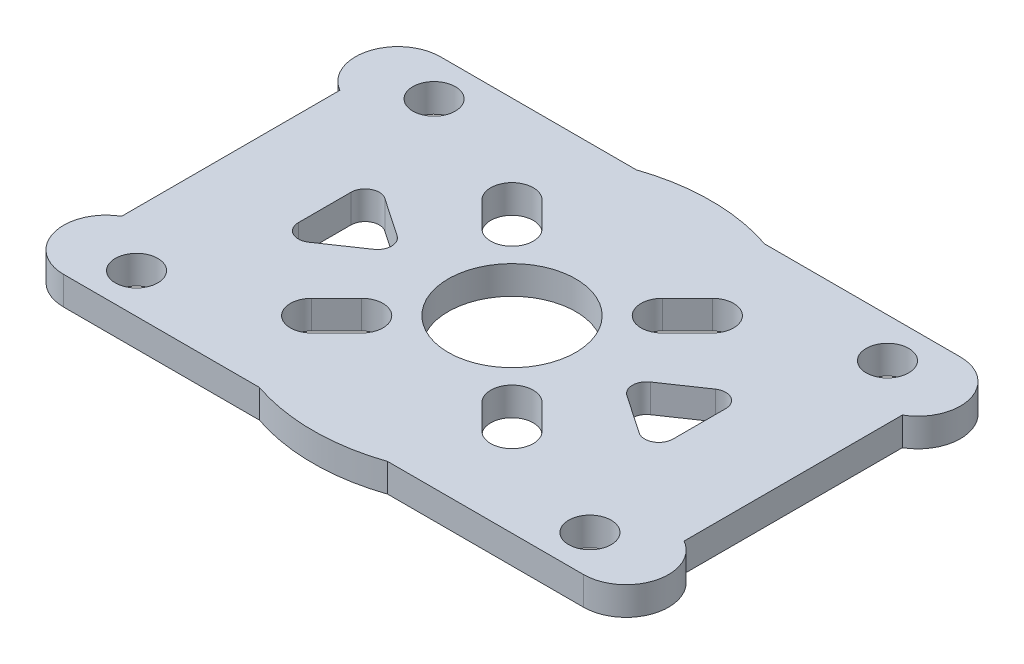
SolidWorks part; units mm, degrees
ref_plane "Front Plane" through (0, 0, 0) normal (0, 0, 1) x (1, 0, 0)
ref_plane "Top Plane" through (0, 0, 0) normal (0, 1, 0) x (1, 0, 0)
ref_plane "Right Plane" through (0, 0, 0) normal (1, 0, 0) x (0, 0, -1)
sketch "Sketch1" plane through (0, 0, 0) normal (0, 1, 0) x (1, 0, 0)
  line L0 (0, -55) -> (0, 55) construction
  line L1 (-18.35, -13.3) -> (-4.5291, -13.3)
  line L2 (-21.35, -10.3) -> (-21.35, 10.3) construction
  line L3 (-18.35, 13.3) -> (-4.5291, 13.3)
  line L4 (21.35, -10.3) -> (21.35, 10.3) construction
  line L5 (-55, 0) -> (55, 0) construction
  line L10 (-7.0711, 7.0711) -> (-5.3033, 5.3033) construction
  line L11 (-6.0104, 8.1317) -> (-4.2426, 6.364)
  line L12 (-8.1317, 6.0104) -> (-6.364, 4.2426)
  line L13 (7.0711, 7.0711) -> (5.3033, 5.3033) construction
  line L14 (8.1317, 6.0104) -> (6.364, 4.2426)
  line L15 (6.0104, 8.1317) -> (4.2426, 6.364)
  line L16 (7.0711, -7.0711) -> (5.3033, -5.3033) construction
  line L17 (6.0104, -8.1317) -> (4.2426, -6.364)
  line L18 (8.1317, -6.0104) -> (6.364, -4.2426)
  line L19 (-7.0711, -7.0711) -> (-5.3033, -5.3033) construction
  line L20 (-8.1317, -6.0104) -> (-6.364, -4.2426)
  line L21 (-6.0104, -8.1317) -> (-4.2426, -6.364)
  line L22 (4.5291, 13.3) -> (18.35, 13.3)
  line L23 (-19.85, 7.7019) -> (-19.85, -7.7019)
  line L24 (4.5291, -13.3) -> (18.35, -13.3)
  line L25 (19.85, 7.7019) -> (19.85, -7.7019)
  line L26 (-13.2249, 1.8579) -> (-13.2249, -1.8579)
  line L27 (-11.6615, -2.6841) -> (-8.9367, -0.8262)
  line L28 (-8.9367, 0.8262) -> (-11.6615, 2.6841)
  line L29 (11.6615, -2.6841) -> (8.9367, -0.8262)
  line L30 (13.2249, 1.8579) -> (13.2249, -1.8579)
  line L31 (8.9367, 0.8262) -> (11.6615, 2.6841)
  circle A0 centre (-16, 10.5) radius 1.5
  circle A1 centre (-16, -10.5) radius 1.5
  circle A2 centre (16, -10.5) radius 1.5
  circle A3 centre (16, 10.5) radius 1.5
  circle A4 centre (0, 0) radius 4.5
  arc A5 (-6.0104, 8.1317) -> (-8.1317, 6.0104) centre (-7.0711, 7.0711) ccw
  arc A6 (-6.364, 4.2426) -> (-4.2426, 6.364) centre (-5.3033, 5.3033) ccw
  arc A7 (8.1317, 6.0104) -> (6.0104, 8.1317) centre (7.0711, 7.0711) ccw
  arc A8 (4.2426, 6.364) -> (6.364, 4.2426) centre (5.3033, 5.3033) ccw
  arc A9 (6.0104, -8.1317) -> (8.1317, -6.0104) centre (7.0711, -7.0711) ccw
  arc A10 (6.364, -4.2426) -> (4.2426, -6.364) centre (5.3033, -5.3033) ccw
  arc A11 (-8.1317, -6.0104) -> (-6.0104, -8.1317) centre (-7.0711, -7.0711) ccw
  arc A12 (-4.2426, -6.364) -> (-6.364, -4.2426) centre (-5.3033, -5.3033) ccw
  arc A14 (4.5291, 13.3) -> (-4.5291, 13.3) centre (0, 0) ccw
  arc A15 (-4.5291, -13.3) -> (4.5291, -13.3) centre (0, 0) ccw
  arc A16 (-8.9367, 0.8262) -> (-8.9367, -0.8262) centre (-9.5, 0) cw
  arc A17 (-11.6615, -2.6841) -> (-13.2249, -1.8579) centre (-12.2249, -1.8579) cw
  arc A18 (-11.6615, 2.6841) -> (-13.2249, 1.8579) centre (-12.2249, 1.8579) ccw
  arc A19 (11.6615, -2.6841) -> (13.2249, -1.8579) centre (12.2249, -1.8579) ccw
  arc A20 (8.9367, 0.8262) -> (8.9367, -0.8262) centre (9.5, 0) ccw
  arc A21 (11.6615, 2.6841) -> (13.2249, 1.8579) centre (12.2249, 1.8579) cw
  arc A22 (-18.35, 13.3) -> (-19.85, 7.7019) centre (-18.35, 10.3) ccw
  arc A23 (-19.85, -7.7019) -> (-18.35, -13.3) centre (-18.35, -10.3) ccw
  arc A24 (19.85, 7.7019) -> (18.35, 13.3) centre (18.35, 10.3) ccw
  arc A25 (18.35, -13.3) -> (19.85, -7.7019) centre (18.35, -10.3) ccw
  point P8 (21.35, 0)
  point P23 (-6.1872, 6.1872)
  point P33 (6.1872, 6.1872)
  point P40 (6.1872, -6.1872)
  point P47 (-6.1872, -6.1872)
  point P52 (0, 0)
  point P55 (-13.2249, 0)
  point P60 (-7.7249, 0)
  point P63 (-13.2249, -3.75)
  point P66 (-13.2249, 3.75)
  dimension "D4" = 3
  dimension "D5" = 9
  dimension "D11" = 14.05
  dimension "D14" = 1
  dimension "D20" = 3
  dimension "D6" = 3
  dimension "D7" = 2.5
  dimension "D8" = 7.5
  dimension "D9" = 45
  dimension "D12" = 7.5
  dimension "D13" = 5.5
  dimension "D15" = 9.5
  dimension "D3" = 32
  dimension "D16" = 16
  dimension "D17" = 21
  dimension "D18" = 10.5
  dimension "D19" = 21.35
  dimension "D21" = 3
  dimension "D22" = 3
  dimension "D23" = 26.6
  dimension "D24" = 21.35
  dimension "D10" = 4
extrude "Boss-Extrude1" add sketch "Sketch1" along normal blind 2
